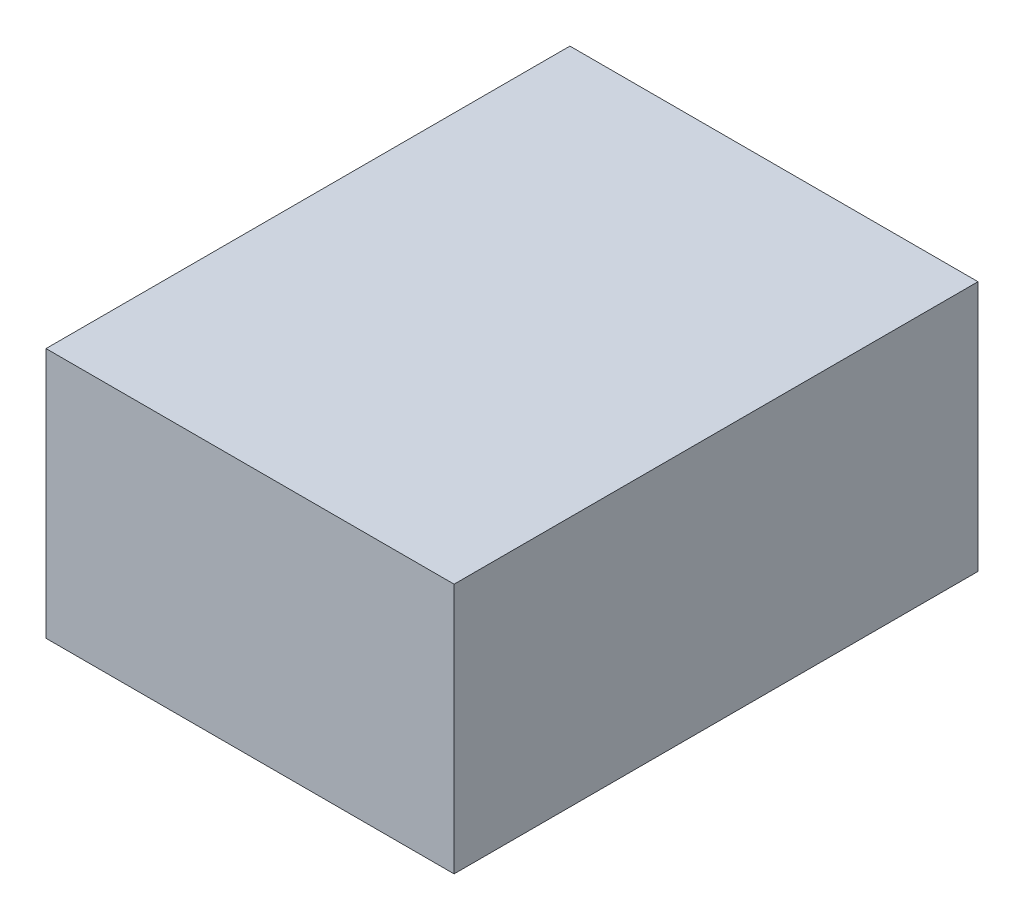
SolidWorks part; units mm, degrees
ref_plane "Front Plane" through (0, 0, 0) normal (0, 0, 1) x (1, 0, 0)
ref_plane "Top Plane" through (0, 0, 0) normal (0, 1, 0) x (1, 0, 0)
ref_plane "Right Plane" through (0, 0, 0) normal (1, 0, 0) x (0, 0, -1)
sketch "Sketch2" plane through (0, 0, 0) normal (0, 1, 0) x (1, 0, 0)
  line L1 (0, 0) -> (76.2, 0)
  line L2 (0, 0) -> (0, -97.8256)
  line L3 (0, -97.8256) -> (76.2, -97.8256)
  line L4 (76.2, 0) -> (76.2, -97.8256)
  dimension "D1" = 76.2
extrude "Extrude1" add sketch "Sketch2" along normal blind 46.8536
sketch "Sketch1" plane through (0, 0, 0) normal (0, 1, 0) x (1, 0, 0)
  arc A0 (0, -97.8256) -> (76.2, -97.8256) centre (38.1, -97.8256) ccw
curve "CompCurve1"
